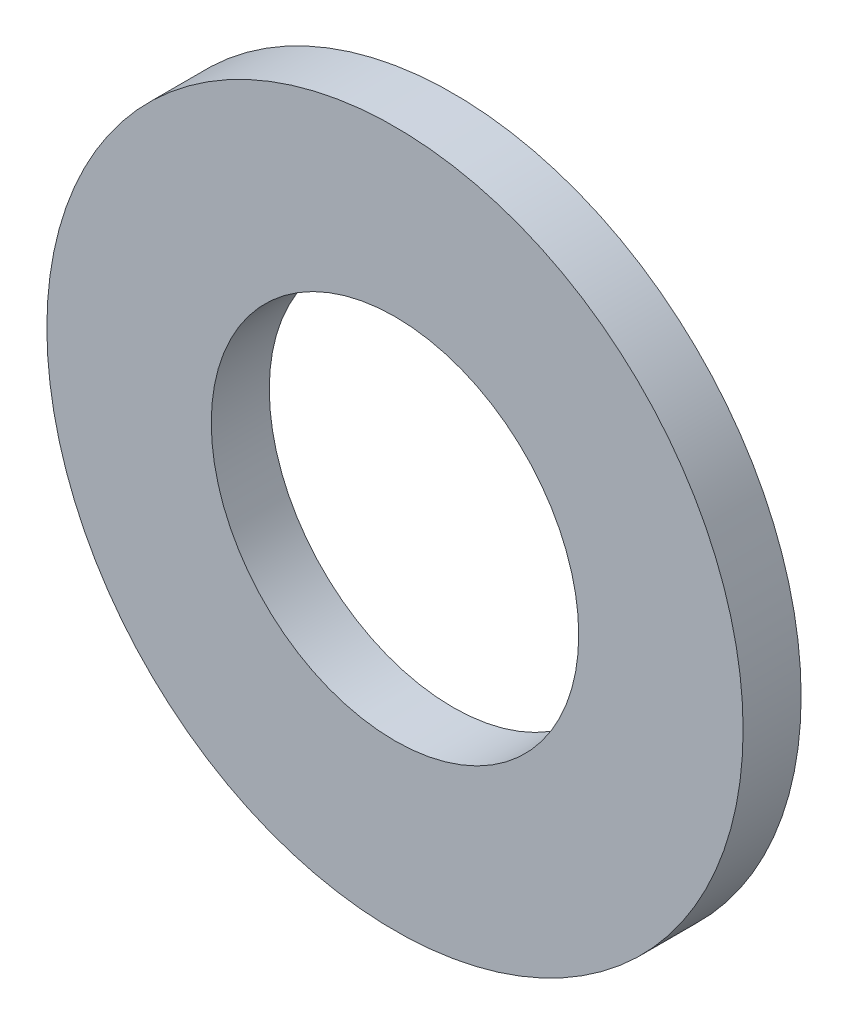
SolidWorks part; units mm, degrees
ref_plane "Plan1" through (0, 0, 0) normal (0, 0, 1) x (1, 0, 0)
ref_plane "Plan2" through (0, 0, 0) normal (0, 1, 0) x (1, 0, 0)
ref_plane "Plan3" through (0, 0, 0) normal (1, 0, 0) x (0, 0, -1)
extrude "Corps" add sketch "E_corps" along normal blind 3
sketch "E_corps" plane through (0, 0, 0) normal (0, 0, 1) x (1, 0, 0)
  circle A0 centre (0, 0) radius 18
  dimension "Diam_base" = 36
extrude "Diamètre_nominal" cut sketch "E_perçage" against normal through all
sketch "E_perçage" plane through (0, 0, 0) normal (0, 0, -1) x (-1, 0, 0)
  circle A0 centre (0, 0) radius 9.5
  dimension "Diamètre_nominal" = 19
